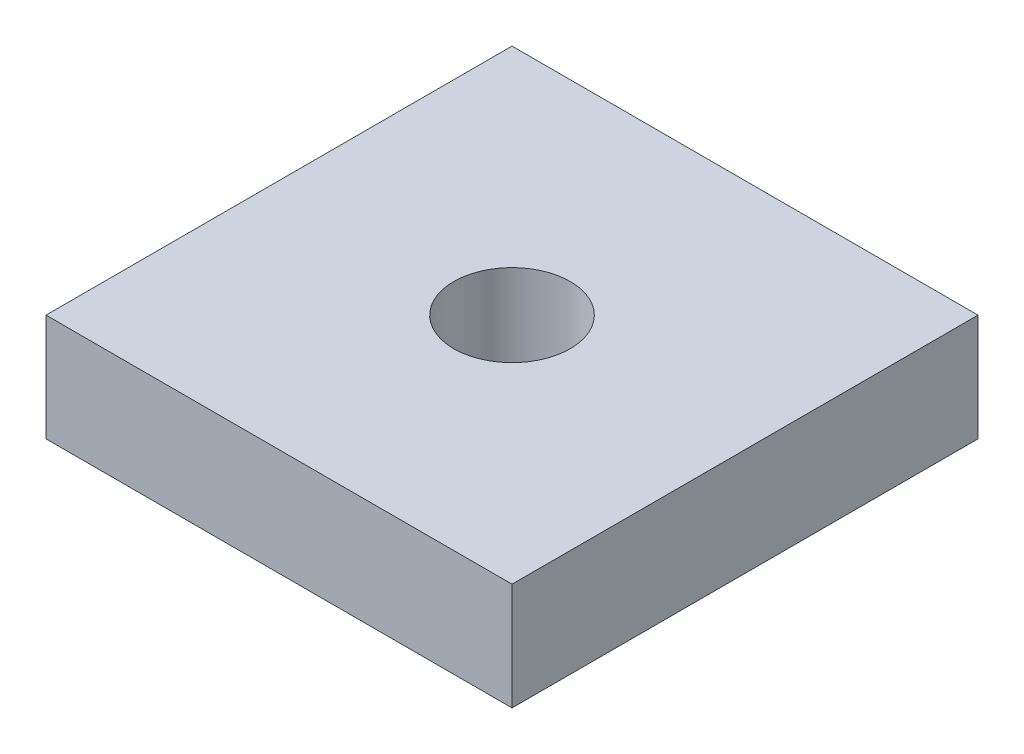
SolidWorks part; units mm, degrees
ref_plane "Front Plane" through (0, 0, 0) normal (0, 0, 1) x (1, 0, 0)
ref_plane "Top Plane" through (0, 0, 0) normal (0, 1, 0) x (1, 0, 0)
ref_plane "Right Plane" through (0, 0, 0) normal (1, 0, 0) x (0, 0, -1)
sketch "Sketch1" plane through (0, 0, 0) normal (0, 1, 0) x (1, 0, 0)
  line L1 (0, 0) -> (38.1, 0)
  line L2 (0, 0) -> (0, 38.1)
  line L3 (0, 38.1) -> (38.1, 38.1)
  line L4 (38.1, 0) -> (38.1, 38.1)
  circle A0 centre (19.05, 19.05) radius 4.7625
  dimension "D1" = 38.1
  dimension "D2" = 38.1
extrude "Boss-Extrude1" add sketch "Sketch1" along normal blind 8.763
